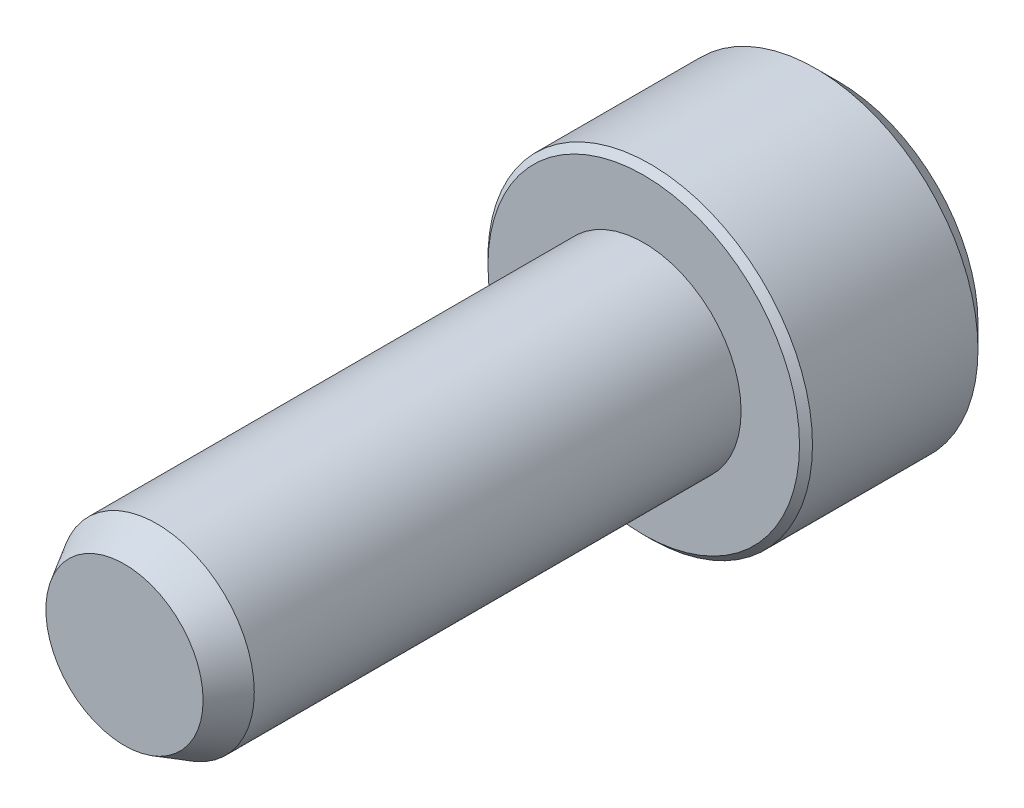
SolidWorks part; units mm, degrees
ref_plane "Plan1" through (0, 0, 0) normal (0, 0, 1) x (1, 0, 0)
ref_plane "Plan2" through (0, 0, 0) normal (0, 1, 0) x (1, 0, 0)
ref_plane "Plan3" through (0, 0, 0) normal (1, 0, 0) x (0, 0, -1)
sketch "Esquisse1" plane through (0, 0, 0) normal (0, 0, 1) x (1, 0, 0)
  circle A0 centre (0, 0) radius 3
  dimension "D1" = 6
extrude "Base-Extrusion" add sketch "Esquisse1" along normal blind 16
sketch "Esquisse2" plane through (0, 0, 0) normal (0, 0, 1) x (1, 0, 0)
  circle A0 centre (0, 0) radius 5
  dimension "D1" = 10
extrude "Boss.-Extru.1" add sketch "Esquisse2" against normal blind 6
ref_plane "Plan4" through (0, 0, -6) normal (0, 0, 1) x (1, 0, 0)
sketch "Esquisse3" plane through (0, 0, -6) normal (0, 0, 1) x (1, 0, 0)
  line L0 (-1.4434, 2.5) -> (1.4434, 2.5)
  line L1 (-1.4434, -2.5) -> (1.4434, -2.5)
  line L2 (-1.4434, 2.5) -> (-2.8868, 0)
  line L3 (1.4434, -2.5) -> (2.8868, 0)
  line L4 (-2.8868, 0) -> (-1.4434, -2.5)
  line L6 (1.4434, 2.5) -> (2.8868, 0)
extrude "Enlèv. mat.-Extru.1" cut sketch "Esquisse3" along normal blind 3
chamfer "Chanfrein1" distance 0.7 angle 45 1 edges at (5, 0, -6)
chamfer "Chanfrein2" distance 1 angle 30 1 edges at (3, 0, 16)
chamfer "Chanfrein3" distance 0.2 angle 45 1 edges at (5, 0, 0)
